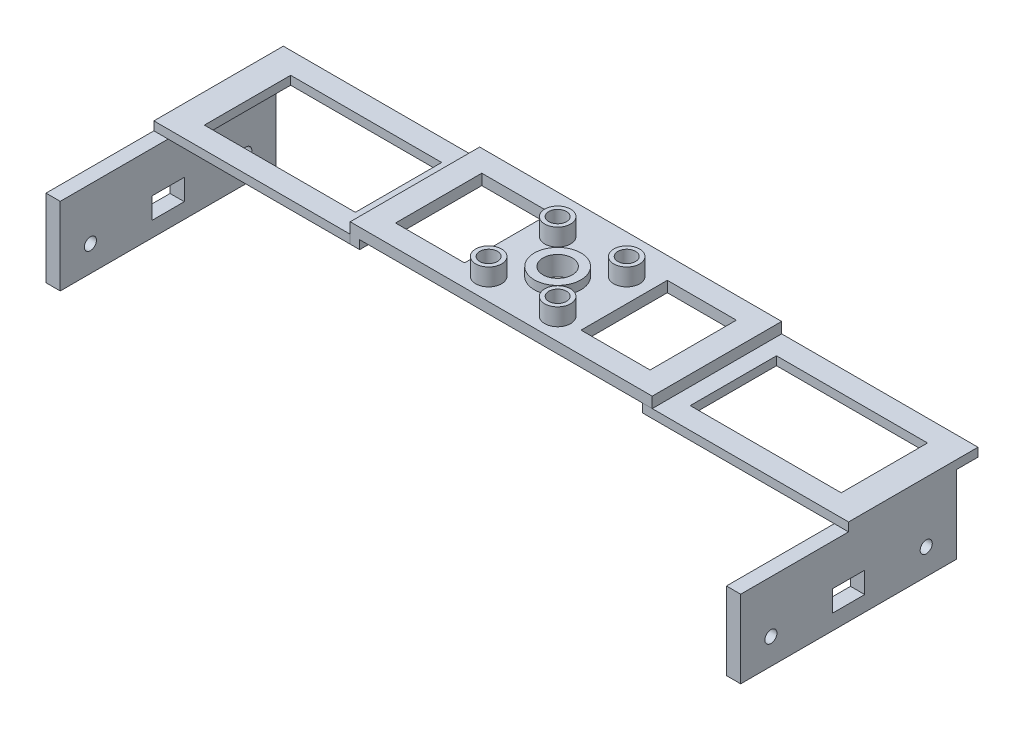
SolidWorks part; units mm, degrees
ref_plane "前视基准面" through (0, 0, 0) normal (0, 0, 1) x (1, 0, 0)
ref_plane "上视基准面" through (0, 0, 0) normal (0, 1, 0) x (1, 0, 0)
ref_plane "右视基准面" through (0, 0, 0) normal (1, 0, 0) x (0, 0, -1)
sketch "草图3" plane through (0, 0, 0) normal (0, 1, 0) x (1, 0, 0)
  line L1 (-35, -13.0809) -> (-20, -13.0809)
  line L5 (-35, 16.9191) -> (35, 16.9191)
  line L6 (35, 16.9191) -> (35, -13.0809)
  line L7 (20, -13.0809) -> (35, -13.0809)
  line L26 (-35, -13.0809) -> (-35, 16.9191)
  arc A0 (-20, -13.0809) -> (20, -13.0809) centre (0, 0) ccw
  dimension "D1" = 30
  dimension "D3" = 15
  dimension "D4" = 15
  dimension "D7" = 40
extrude "凸台-拉伸1" add sketch "草图3" along normal blind 7.5 contours L1 A0 L7 L6 L5 L26
sketch "草图8" plane through (0, 7.5, 0) normal (0, 1, 0) x (1, 0, 0)
  circle A0 centre (0, 0) radius 4.4
extrude "切除-拉伸2" cut sketch "草图8" against normal blind 1 contours A0
sketch "草图9" plane through (0, 6.5, 0) normal (0, 1, 0) x (1, 0, 0)
  circle A0 centre (0, 0) radius 3.4
extrude "切除-拉伸3" cut sketch "草图9" against normal blind 8
sketch "草图16" plane through (0, 7.5, 0) normal (0, 1, 0) x (1, 0, 0)
  line L1 (-8, -8) -> (8, -8)
  line L2 (-8, -8) -> (-8, 8)
  line L3 (-8, 8) -> (8, 8)
  line L4 (8, -8) -> (8, 8)
  line L5 (-8, -8) -> (8, 8) construction
  line L6 (-8, 8) -> (8, -8) construction
  point P0 (0, 0)
  dimension "D1" = 16
  dimension "D2" = 16
sketch "草图17" plane through (0, 7.5, 0) normal (0, 1, 0) x (1, 0, 0)
  circle A0 centre (8, 8) radius 2.05
  circle A1 centre (-8, 8) radius 2.05
  circle A2 centre (-8, -8) radius 2.05
  circle A3 centre (8, -8) radius 2.05
  circle A4 centre (-8, 8) radius 3
  circle A5 centre (8, 8) radius 3
  circle A6 centre (-8, -8) radius 3
  circle A7 centre (8, -8) radius 3
extrude "凸台-拉伸4" add sketch "草图17" along normal blind 4
sketch "草图18" plane through (0, 7.5, 0) normal (0, 1, 0) x (1, 0, 0)
  circle A0 centre (0, 0) radius 4.4
  circle A1 centre (0, 0) radius 5.4
extrude "凸台-拉伸5" add sketch "草图18" along normal blind 1
sketch "草图20" plane through (0, 7.5, 0) normal (0, 1, 0) x (1, 0, 0)
  line L1 (-7.5, -12) -> (7.5, -12)
  line L2 (-7.5, -12) -> (-7.5, -20)
  line L3 (-7.5, -20) -> (7.5, -20)
  line L4 (7.5, -12) -> (7.5, -20)
  line L5 (-7.5, -12) -> (7.5, -20) construction
  line L6 (-7.5, -20) -> (7.5, -12) construction
  point P0 (0, -16)
  dimension "D1" = 15
  dimension "D2" = 8
  dimension "D3" = 0
sketch "草图42" plane through (0, 7.5, 0) normal (0, 1, 0) x (1, 0, 0)
  line L1 (-29.8362, -32.5182) -> (33.5963, -32.5182)
  line L2 (-29.8362, -32.5182) -> (-29.8362, -20.5182)
  line L3 (-29.8362, -20.5182) -> (33.5963, -20.5182)
  line L4 (33.5963, -32.5182) -> (33.5963, -20.5182)
extrude "切除-拉伸15" cut sketch "草图42" against normal blind 10
sketch "草图43" plane through (0, 0, 0) normal (0, -1, 0) x (1, 0, 0)
  line L0 (-35, -16.9191) -> (35, -16.9191) construction
  line L1 (-35, 13.0809) -> (-32.8, 13.0809)
  line L2 (-35, 13.0809) -> (-35, -16.9191)
  line L3 (-35, -16.9191) -> (-32.8, -16.9191)
  line L4 (-32.8, 13.0809) -> (-32.8, -16.9191)
  line L6 (35, 13.0809) -> (32.8, 13.0809)
  line L7 (35, 13.0809) -> (35, -16.9191)
  line L8 (35, -16.9191) -> (32.8, -16.9191)
  line L9 (32.8, 13.0809) -> (32.8, -16.9191)
  dimension "D1" = 2.2
  dimension "D2" = 2.2
extrude "凸台-拉伸21" add sketch "草图43" along normal blind 10
sketch "草图44" plane through (-35, 0, 0) normal (-1, 0, 0) x (0, 0, 1)
  line L0 (-16.9191, 7.5) -> (-16.9191, -10) construction
  line L1 (13.0809, -10) -> (-16.9191, -10)
  line L2 (13.0809, -10) -> (13.0809, -8)
  line L3 (13.0809, -8) -> (-16.9191, -8)
  line L4 (-16.9191, -10) -> (-16.9191, -8)
  dimension "D1" = 2
extrude "凸台-拉伸22" add sketch "草图44" along normal blind 45.5
sketch "草图45" plane through (35, 0, 0) normal (1, 0, 0) x (0, 0, -1)
  line L1 (-13.0809, -10) -> (16.9191, -10)
  line L2 (-13.0809, -10) -> (-13.0809, -8)
  line L3 (-13.0809, -8) -> (16.9191, -8)
  line L4 (16.9191, -10) -> (16.9191, -8)
  dimension "D1" = 2
extrude "凸台-拉伸23" add sketch "草图45" along normal blind 45.5
sketch "草图46" plane through (0, -10, 0) normal (0, -1, 0) x (1, 0, 0)
  line L1 (-80.5, 38.0809) -> (-78.5, 38.0809)
  line L2 (-80.5, 38.0809) -> (-80.5, -11.9191)
  line L3 (-80.5, -11.9191) -> (-78.5, -11.9191)
  line L4 (-78.5, 38.0809) -> (-78.5, -11.9191)
  line L5 (80.5, -11.9191) -> (78.5, -11.9191)
  line L12 (-80.5, -16.9191) -> (-32.8, -16.9191) construction
  line L13 (32.8, -16.9191) -> (80.5, -16.9191) construction
  line L14 (78.5, 38.0809) -> (78.5, -11.9191)
  line L15 (80.5, 38.0809) -> (78.5, 38.0809)
  line L16 (80.5, 38.0809) -> (80.5, -11.9191)
  dimension "D1" = 2
  dimension "D2" = 80.5
  dimension "D3" = 5
  dimension "D4" = 50
  dimension "D5" = 80.5
  dimension "D6" = 2
  dimension "D7" = 50
  dimension "D8" = 5
  dimension "D10" = 90
extrude "凸台-拉伸24" add sketch "草图46" along normal blind 18
sketch "草图47" plane through (-80.5, 0, 0) normal (-1, 0, 0) x (0, 0, 1)
  line L0 (-11.9191, -28) -> (-11.9191, -10) construction
  line L1 (9.3309, -19.55) -> (16.8309, -19.55)
  line L2 (9.3309, -19.55) -> (9.3309, -24.45)
  line L3 (9.3309, -24.45) -> (16.8309, -24.45)
  line L4 (16.8309, -19.55) -> (16.8309, -24.45)
  line L8 (38.0809, -28) -> (38.0809, -10) construction
  line L9 (38.0809, -28) -> (-11.9191, -28) construction
  circle A0 centre (31.0809, -22) radius 1.4
  circle A1 centre (-4.9191, -22) radius 1.4
  dimension "D5" = 7
  dimension "D9" = 2.8
  dimension "D10" = 2.8
  dimension "D2" = 21.25
  dimension "D3" = 6
  dimension "D4" = 7.5
  dimension "D6" = 7
  dimension "D7" = 2.45
  dimension "D8" = 6
  dimension "D11" = 4.9
extrude "切除-拉伸16" cut sketch "草图47" against normal through all both and the other way through all
sketch "草图48" plane through (80.5, 0, 0) normal (1, 0, 0) x (0, 0, -1)
  line L0 (11.9191, -28) -> (-38.0809, -28) construction
  line L1 (-28.7715, -22) -> (-29.9262, -20)
  line L2 (-29.9262, -20) -> (-32.2356, -20)
  line L3 (-32.2356, -20) -> (-33.3903, -22)
  line L4 (-33.3903, -22) -> (-32.2356, -24)
  line L5 (-32.2356, -24) -> (-29.9262, -24)
  line L6 (-29.9262, -24) -> (-28.7715, -22)
  line L7 (7.2285, -22) -> (6.0738, -20)
  line L8 (6.0738, -20) -> (3.7644, -20)
  line L9 (3.7644, -20) -> (2.6097, -22)
  line L10 (2.6097, -22) -> (3.7644, -24)
  line L11 (3.7644, -24) -> (6.0738, -24)
  line L12 (6.0738, -24) -> (7.2285, -22)
  circle A0 centre (-31.0809, -22) radius 2 construction
  circle A1 centre (4.9191, -22) radius 2 construction
  dimension "D1" = 4
  dimension "D2" = 4
sketch "草图49" plane through (0, 7.5, 0) normal (0, 1, 0) x (1, 0, 0)
  line L0 (-20, -13.0809) -> (20, -13.0809)
  line L1 (-20, -13.0809) -> (-20, -22.0354)
  line L2 (20, -13.0809) -> (20, -22.0354)
  line L3 (-20, -22.0354) -> (20, -22.0354)
extrude "切除-拉伸17" cut sketch "草图49" against normal through all
sketch "草图50" plane through (0, 7.5, 0) normal (0, 1, 0) x (1, 0, 0)
  line L0 (80.5, -13.0809) -> (35, -13.0809) construction
  line L1 (-35, 16.9191) -> (35, 16.9191)
  line L2 (-35, 16.9191) -> (-35, -13.0809)
  line L3 (-35, -13.0809) -> (35, -13.0809)
  line L4 (35, 16.9191) -> (35, -13.0809)
  circle A0 centre (0, 0) radius 3.4
extrude "切除-拉伸18" cut sketch "草图50" against normal blind 5 contours M9 M6 M7 M8 M10 M12 M14 M13 M11
sketch "草图51" plane through (0, 11.5, 0) normal (0, 1, 0) x (1, 0, 0)
  circle A0 centre (-8, 8) radius 3
  circle A1 centre (8, 8) radius 3
  circle A2 centre (-8, -8) radius 3
  circle A3 centre (8, -8) radius 3
extrude "切除-拉伸19" cut sketch "草图51" against normal blind 5
sketch "草图52" plane through (0, 7.5, 0) normal (0, 1, 0) x (1, 0, 0)
  circle A0 centre (-8, -8) radius 2.05
  circle A1 centre (-8, 8) radius 2.05
  circle A2 centre (8, 8) radius 2.05
  circle A3 centre (8, -8) radius 2.05
extrude "切除-拉伸20" cut sketch "草图52" against normal blind 5
sketch "草图53" plane through (0, 8.5, 0) normal (0, 1, 0) x (1, 0, 0)
  circle A0 centre (0, 0) radius 5.4
  circle A1 centre (0, 0) radius 4.4
extrude "切除-拉伸21" cut sketch "草图53" against normal blind 4
ref_plane "基准面1" through (0, -8, 0) normal (0, 1, 0) x (1, 0, 0)
split "分割1" trim tools "基准面1" bodies to split 159 resulting bodies 160 161 162
sketch "草图54" plane through (0, -8, 0) normal (0, 1, 0) x (1, 0, 0)
  line L1 (-35, 16.9191) -> (-32.8, 16.9191)
  line L2 (-35, 16.9191) -> (-35, -13.0809)
  line L3 (-35, -13.0809) -> (-32.8, -13.0809)
  line L4 (-32.8, 16.9191) -> (-32.8, -13.0809)
  line L5 (35, 16.9191) -> (32.8, 16.9191)
  line L6 (35, 16.9191) -> (35, -13.0809)
  line L7 (35, -13.0809) -> (32.8, -13.0809)
  line L8 (32.8, 16.9191) -> (32.8, -13.0809)
extrude "切除-拉伸22" cut sketch "草图54" along normal blind 5
move or copy body "实体-移动/复制1" bodies to move or copy 163 copy no translate (0, -8, 0) parameters "D1"=0, "D2"=8, "D3"=0
sketch "草图55" plane through (-78.5, 0, 0) normal (1, 0, 0) x (0, 0, -1)
  line L1 (-16.8309, -19.55) -> (-9.3309, -19.55)
  line L2 (-16.8309, -19.55) -> (-16.8309, -24.45)
  line L3 (-16.8309, -24.45) -> (-9.3309, -24.45)
  line L4 (-9.3309, -19.55) -> (-9.3309, -24.45)
  line L5 (-38.0809, -10) -> (11.9191, -10)
  line L6 (-38.0809, -10) -> (-38.0809, -28)
  line L7 (-38.0809, -28) -> (11.9191, -28)
  line L8 (11.9191, -10) -> (11.9191, -28)
  circle A0 centre (-31.0809, -22) radius 1.4
  circle A1 centre (4.9191, -22) radius 1.4
extrude "凸台-拉伸25" add sketch "草图55" along normal blind 1.3
sketch "草图56" plane through (78.5, 0, 0) normal (-1, 0, 0) x (0, 0, 1)
  line L1 (38.0809, -10) -> (-11.9191, -10)
  line L2 (38.0809, -10) -> (38.0809, -28)
  line L3 (38.0809, -28) -> (-11.9191, -28)
  line L4 (-11.9191, -10) -> (-11.9191, -28)
  line L5 (16.8309, -19.55) -> (9.3309, -19.55)
  line L6 (16.8309, -19.55) -> (16.8309, -24.45)
  line L7 (16.8309, -24.45) -> (9.3309, -24.45)
  line L8 (9.3309, -19.55) -> (9.3309, -24.45)
  circle A0 centre (-4.9191, -22) radius 1.4
  circle A1 centre (31.0809, -22) radius 1.4
extrude "凸台-拉伸26" add sketch "草图56" along normal blind 1.3
sketch "草图57" plane through (0, -5.5, 0) normal (0, 1, 0) x (1, 0, 0)
  circle A0 centre (-8, -8) radius 2.05
  circle A1 centre (8, -8) radius 2.05
  circle A2 centre (8, 8) radius 2.05
  circle A3 centre (-8, 8) radius 2.05
extrude "切除-拉伸23" cut sketch "草图57" against normal blind 2
sketch "草图58" plane through (0, -1.5, 0) normal (0, 1, 0) x (1, 0, 0)
  circle A0 centre (0, 0) radius 3.4
  circle A1 centre (0, 0) radius 4.4
extrude "切除-拉伸24" cut sketch "草图58" against normal blind 2
sketch "草图59" plane through (0, -11, 0) normal (0, -1, 0) x (1, 0, 0)
  line L0 (32.8, -16.9191) -> (80.5, -16.9191) construction
  line L1 (-35, 13.0809) -> (-32.8, 13.0809)
  line L2 (-35, 13.0809) -> (-35, -16.9191)
  line L3 (-35, -16.9191) -> (-32.8, -16.9191)
  line L4 (-32.8, 13.0809) -> (-32.8, -16.9191)
  line L5 (32.8, 13.0809) -> (35, 13.0809)
  line L6 (32.8, 13.0809) -> (32.8, -16.9191)
  line L7 (32.8, -16.9191) -> (35, -16.9191)
  line L8 (35, 13.0809) -> (35, -16.9191)
  line L9 (35, 13.0809) -> (35, -16.9191) construction
extrude "切除-拉伸25" cut sketch "草图59" against normal blind 1
sketch "草图60" plane through (0, -8, 0) normal (0, 1, 0) x (1, 0, 0)
  line L0 (38.8, 11.9191) -> (73.8, 11.9191)
  line L1 (38.8, 11.9191) -> (38.8, -8.0809)
  line L2 (73.8, 11.9191) -> (73.8, -8.0809)
  line L3 (38.8, -8.0809) -> (73.8, -8.0809)
  line L4 (-73.8, 11.9191) -> (-38.8, 11.9191)
  line L5 (-73.8, 11.9191) -> (-73.8, -8.0809)
  line L6 (-38.8, 11.9191) -> (-38.8, -8.0809)
  line L7 (-73.8, -8.0809) -> (-38.8, -8.0809)
  line L8 (80.5, 16.9191) -> (32.8, 16.9191) construction
  line L9 (80.5, -13.0809) -> (32.8, -13.0809) construction
  line L10 (32.8, -13.0809) -> (32.8, 16.9191) construction
  line L11 (-32.8, 16.9191) -> (-32.8, -13.0809) construction
  dimension "D1" = 5
  dimension "D2" = 5
  dimension "D3" = 6
  dimension "D4" = 6
  dimension "D5" = 35
extrude "切除-拉伸26" cut sketch "草图60" against normal blind 10
sketch "草图61" plane through (0, -5.5, 0) normal (0, 1, 0) x (1, 0, 0)
  line L0 (-35, 16.9191) -> (-35, -13.0809) construction
  line L1 (-29.5, 11.9191) -> (-13.5, 11.9191)
  line L2 (-29.5, 11.9191) -> (-29.5, -8.0809)
  line L3 (-29.5, -8.0809) -> (-13.5, -8.0809)
  line L4 (-13.5, 11.9191) -> (-13.5, -8.0809)
  line L5 (13.5, 11.9191) -> (29.5, 11.9191)
  line L6 (13.5, 11.9191) -> (13.5, -8.0809)
  line L7 (13.5, -8.0809) -> (29.5, -8.0809)
  line L8 (29.5, 11.9191) -> (29.5, -8.0809)
  line L9 (35, -13.0809) -> (35, 16.9191) construction
  line L10 (35, 16.9191) -> (-35, 16.9191) construction
  line L11 (-35, -13.0809) -> (35, -13.0809) construction
  dimension "D1" = 5.5
  dimension "D2" = 5.5
  dimension "D3" = 16
  dimension "D4" = 5
  dimension "D5" = 5
extrude "切除-拉伸27" cut sketch "草图61" against normal blind 10
